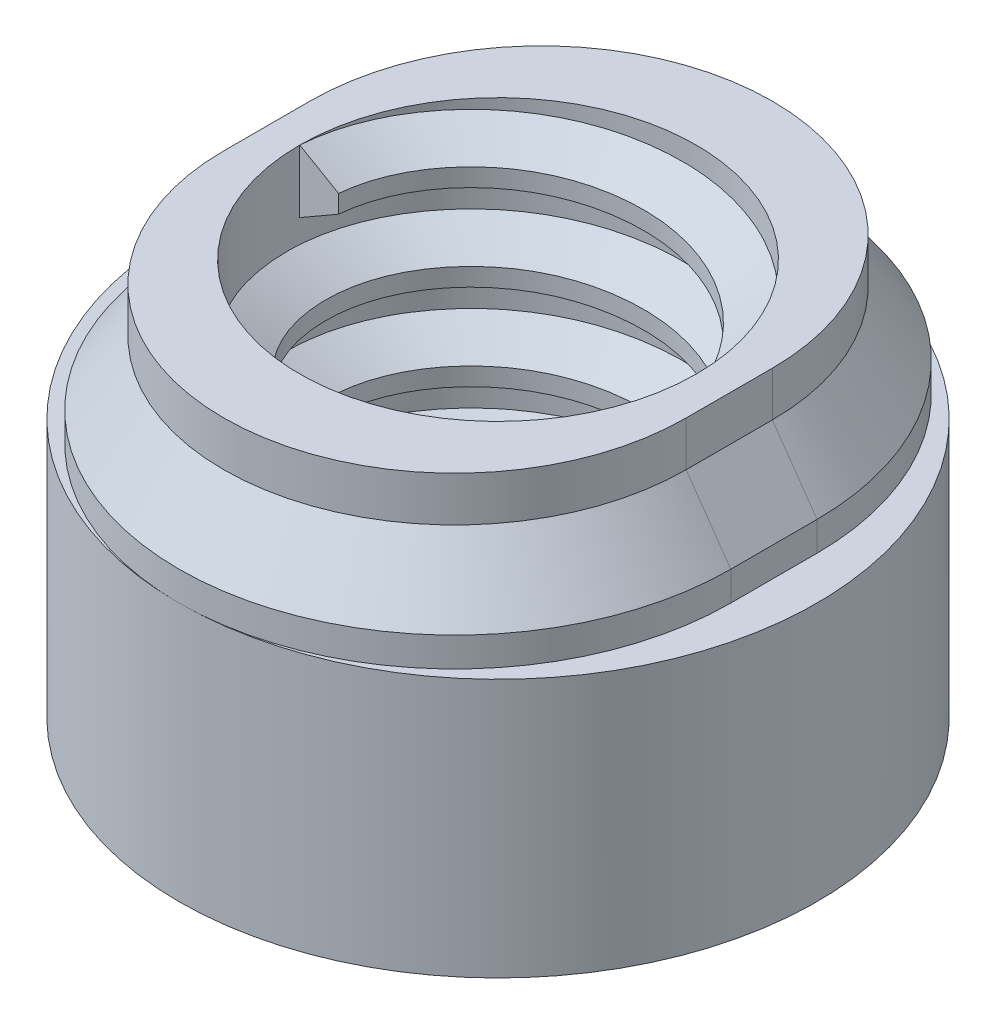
SolidWorks part; units mm, degrees
ref_plane "Front Plane" through (0, 0, 0) normal (0, 0, 1) x (1, 0, 0)
ref_plane "Top Plane" through (0, 0, 0) normal (0, 1, 0) x (1, 0, 0)
ref_plane "Right Plane" through (0, 0, 0) normal (1, 0, 0) x (0, 0, -1)
sketch "Sketch1" plane through (0, 0, 0) normal (0, 0, 1) x (1, 0, 0)
  line L0 (-6.35, 2.4765) -> (6.35, 2.4765) construction
  line L1 (-6.35, 0) -> (0, 0) construction
  line L2 (-6.35, -0.254) -> (-6.35, 0) construction
  line L3 (-6.35, 0) -> (-6.35, 2.4765) construction
  line L4 (0, 0) -> (0, 2.4765) construction
  circle A0 centre (-6.35, 2.4765) radius 2.7305
  circle A1 centre (6.35, 2.4765) radius 2.7305
  dimension "D1" = 5.461
  dimension "D2" = 12.7
  dimension "D3" = 0.254
extrude "Boss-Extrude1" add sketch "Sketch1" along normal blind 53.975
sketch "Sketch2" plane through (0, 0, 53.975) normal (0, 0, 1) x (1, 0, 0)
  circle A0 centre (-6.35, 2.4765) radius 4.7625
  circle A1 centre (6.35, 2.4765) radius 4.7625
  dimension "D1" = 9.525
extrude "Boss-Extrude2" add sketch "Sketch2" along normal blind 5.08
sketch "Sketch3" plane through (0, 0, 59.055) normal (0, 0, 1) x (1, 0, 0)
  line L0 (-6.35, 0.4445) -> (-6.35, 4.5085) construction
  line L3 (-6.858, 0.4445) -> (-6.858, 4.5085)
  line L6 (-5.842, 0.4445) -> (-5.842, 4.5085)
  line L7 (6.35, 0.4445) -> (6.35, 4.5085) construction
  line L8 (5.842, 0.4445) -> (5.842, 4.5085)
  line L9 (6.858, 0.4445) -> (6.858, 4.5085)
  circle A5 centre (6.35, 2.4765) radius 4.7625 construction
  circle A6 centre (-6.35, 2.4765) radius 4.7625 construction
  circle A7 centre (6.35, 2.4765) radius 4.7625 construction
  circle A8 centre (-6.35, 2.4765) radius 4.7625 construction
  arc A9 (-6.858, 0.4445) -> (-5.842, 0.4445) centre (-6.35, 0.4445) ccw
  arc A10 (-5.842, 4.5085) -> (-6.858, 4.5085) centre (-6.35, 4.5085) ccw
  arc A11 (5.842, 0.4445) -> (6.858, 0.4445) centre (6.35, 0.4445) ccw
  arc A12 (6.858, 4.5085) -> (5.842, 4.5085) centre (6.35, 4.5085) ccw
  point P7 (-6.35, 2.4765)
  point P13 (6.35, 2.4765)
  dimension "D1" = 4.064
  dimension "D2" = 1.016
  dimension "D3" = 1.016
extrude "Cut-Extrude1" cut sketch "Sketch3" against normal blind 3.81
thread "Thread1" pitch 1.27 start angle 0, offset 1.27, length 11.43, pitch 1.27, diameter 5.461
ref_plane "Plane1" through (9.0805, 2.4765, -1.27) normal (0, 1, 0) x (-1, 0, 0)
sketch "Thread Profile1" plane through (9.0805, 2.4765, -1.27) normal (0, 1, 0) x (-1, 0, 0)
  line L0 (0, 0) -> (0, 1.27) construction
  line L1 (0, 0) -> (0.6874, 0.3969)
  line L2 (0.6874, 0.3969) -> (0.6874, 0.5556)
  line L3 (0.6874, 0.5556) -> (0, 0.9525)
  line L4 (0.6874, 0.4762) -> (0, 0.4762) construction
  line L11 (0, 0) -> (0, 0.9525)
  point P2 (0, 0)
  dimension "Pitch" = 1.27
  dimension "Profile_Angle" = 60
  dimension "Profile_Land" = 0.1588
  dimension "Profile_Height" = 0.6874
thread "Thread2" pitch 1.27 start angle 0, offset 1.27, length 11.43, pitch 1.27, diameter 5.461
ref_plane "Plane2" through (-3.6195, 2.4765, -1.27) normal (0, 1, 0) x (-1, 0, 0)
sketch "Thread Profile2" plane through (-3.6195, 2.4765, -1.27) normal (0, 1, 0) x (-1, 0, 0)
  line L0 (0, 0) -> (0, 1.27) construction
  line L1 (0, 0) -> (0.6874, 0.3969)
  line L2 (0.6874, 0.3969) -> (0.6874, 0.5556)
  line L3 (0.6874, 0.5556) -> (0, 0.9525)
  line L4 (0.6874, 0.4762) -> (0, 0.4762) construction
  line L11 (0, 0) -> (0, 0.9525)
  point P2 (0, 0)
  dimension "Pitch" = 1.27
  dimension "Profile_Angle" = 60
  dimension "Profile_Land" = 0.1588
  dimension "Profile_Height" = 0.6874
sketch "Sketch9" plane through (0, 0, 0) normal (0, 1, 0) x (1, 0, 0)
  line L0 (-11.1125, -59.055) -> (-1.5875, -59.055) construction
  line L2 (1.5875, -59.055) -> (11.1125, -59.055) construction
  line L3 (6.35, -59.055) -> (6.35, -68.58) construction
  line L4 (-6.35, -59.055) -> (-6.35, -68.58) construction
  circle A0 centre (-6.35, -68.58) radius 4.699
  circle A1 centre (6.35, -68.58) radius 4.699
  circle A2 centre (-6.35, -68.58) radius 2.921
  circle A3 centre (6.35, -68.58) radius 2.921
  dimension "D2" = 9.398
  dimension "D3" = 5.842
  dimension "D1" = 9.525
extrude "Boss-Extrude3" add sketch "Sketch9" along normal blind 3.81 separate body
sketch "Sketch11" plane through (0, 3.81, 0) normal (0, 1, 0) x (1, 0, 0)
  line L0 (-6.35, -69.215) -> (-6.35, -67.945) construction
  line L1 (-10.414, -69.215) -> (-10.414, -67.945)
  line L2 (-2.286, -69.215) -> (-2.286, -67.945)
  line L3 (6.35, -69.215) -> (6.35, -67.945) construction
  line L4 (2.286, -69.215) -> (2.286, -67.945)
  line L5 (10.414, -69.215) -> (10.414, -67.945)
  circle A0 centre (6.35, -68.58) radius 4.699 construction
  circle A1 centre (-6.35, -68.58) radius 4.699 construction
  circle A2 centre (6.35, -68.58) radius 4.699 construction
  circle A3 centre (-6.35, -68.58) radius 4.699 construction
  arc A4 (-10.414, -69.215) -> (-2.286, -69.215) centre (-6.35, -69.215) ccw
  arc A5 (-2.286, -67.945) -> (-10.414, -67.945) centre (-6.35, -67.945) ccw
  arc A6 (2.286, -69.215) -> (10.414, -69.215) centre (6.35, -69.215) ccw
  arc A7 (10.414, -67.945) -> (2.286, -67.945) centre (6.35, -67.945) ccw
  circle A8 centre (-6.35, -68.58) radius 2.921
  circle A9 centre (6.35, -68.58) radius 2.921
  circle A10 centre (6.35, -68.58) radius 2.921 construction
  circle A11 centre (-6.35, -68.58) radius 2.921 construction
  point P8 (-6.35, -68.58)
  point P13 (6.35, -68.58)
  dimension "D1" = 8.128
  dimension "D2" = 8.128
extrude "Boss-Extrude4" add sketch "Sketch11" along normal blind 1.3716
chamfer "Chamfer1" distance 0.9398 angle 35 4 edges at (-6.35, 5.1816, 63.881) (-10.414, 5.1816, 68.58) (-2.286, 5.1816, 68.58) (-6.35, 5.1816, 73.279)
sketch "Sketch12" plane through (0, 5.1816, 0) normal (0, 1, 0) x (1, 0, 0)
  line L2 (-2.9441, -69.215) -> (-2.9441, -67.945)
  line L3 (-9.7559, -67.945) -> (-9.7559, -69.215)
  line L4 (-2.9441, -69.215) -> (-2.9441, -67.945)
  line L5 (-9.7559, -67.945) -> (-9.7559, -69.215)
  circle A0 centre (-6.35, -68.58) radius 2.921 construction
  circle A1 centre (-6.35, -68.58) radius 2.921
  arc A2 (-2.9441, -67.945) -> (-9.7559, -67.945) centre (-6.35, -67.945) ccw
  arc A3 (-9.7559, -69.215) -> (-2.9441, -69.215) centre (-6.35, -69.215) ccw
  arc A4 (-2.9441, -67.945) -> (-9.7559, -67.945) centre (-6.35, -67.945) ccw
  arc A5 (-9.7559, -69.215) -> (-2.9441, -69.215) centre (-6.35, -69.215) ccw
  dimension "D1" = 0
extrude "Boss-Extrude5" add sketch "Sketch12" along normal blind 0.6604
chamfer "Chamfer2" distance 0.9398 angle 35 4 edges at (6.35, 5.1816, 63.881) (2.286, 5.1816, 68.58) (10.414, 5.1816, 68.58) (6.35, 5.1816, 73.279)
sketch "Sketch13" plane through (0, 5.1816, 0) normal (0, 1, 0) x (1, 0, 0)
  line L2 (9.7559, -69.215) -> (9.7559, -67.945)
  line L3 (2.9441, -67.945) -> (2.9441, -69.215)
  line L4 (9.7559, -69.215) -> (9.7559, -67.945)
  line L5 (2.9441, -67.945) -> (2.9441, -69.215)
  circle A1 centre (6.35, -68.58) radius 2.921
  circle A2 centre (6.35, -68.58) radius 2.921
  arc A4 (9.7559, -67.945) -> (2.9441, -67.945) centre (6.35, -67.945) ccw
  arc A5 (2.9441, -69.215) -> (9.7559, -69.215) centre (6.35, -69.215) ccw
  arc A6 (9.7559, -67.945) -> (2.9441, -67.945) centre (6.35, -67.945) ccw
  arc A7 (2.9441, -69.215) -> (9.7559, -69.215) centre (6.35, -69.215) ccw
  dimension "D1" = 0
  dimension "D2" = 0
extrude "Boss-Extrude6" add sketch "Sketch13" along normal blind 0.6604
thread "Thread3" pitch 1.0583 start angle 0, offset 0, length 6.35, pitch 1.27, diameter 5.842
ref_plane "Plane3" through (-9.271, 5.842, 68.58) normal (0, 0, 1) x (-1, 0, 0)
sketch "Thread Profile3" plane through (-9.271, 5.842, 68.58) normal (0, 0, 1) x (-1, 0, 0)
  line L0 (0, 0) -> (0, 1.0583) construction
  line L11 (0, 0) -> (0, 0.926)
  line L12 (0, 0.926) -> (-0.5728, 0.5953)
  line L13 (-0.5728, 0.5953) -> (-0.5728, 0.3307)
  line L15 (-0.5728, 0.3307) -> (0, 0)
  line L17 (-0.5728, 0.463) -> (0, 0.463) construction
  point P2 (0, 0)
  dimension "Pitch" = 1.0583
  dimension "Profile_Angle" = 60
  dimension "Profile_Land" = 0.2646
  dimension "Profile_Height" = 0.5728
thread "Thread4" pitch 1.0583 start angle 0, offset 0, length 6.35, pitch 1.27, diameter 5.842
ref_plane "Plane4" through (3.429, 5.842, 68.58) normal (0, 0, 1) x (-1, 0, 0)
sketch "Thread Profile4" plane through (3.429, 5.842, 68.58) normal (0, 0, 1) x (-1, 0, 0)
  line L0 (0, 0) -> (0, 1.0583) construction
  line L11 (0, 0) -> (0, 0.926)
  line L12 (0, 0.926) -> (-0.5728, 0.5953)
  line L13 (-0.5728, 0.5953) -> (-0.5728, 0.3307)
  line L15 (-0.5728, 0.3307) -> (0, 0)
  line L17 (-0.5728, 0.463) -> (0, 0.463) construction
  point P2 (0, 0)
  dimension "Pitch" = 1.0583
  dimension "Profile_Angle" = 60
  dimension "Profile_Land" = 0.2646
  dimension "Profile_Height" = 0.5728
sketch "Sketch8" plane through (0, 0, 0) normal (0, 0, 1) x (1, 0, 0)
  line L1 (-12.7, 0) -> (12.7, 0)
  line L2 (-12.7, 0) -> (-12.7, -3.81)
  line L3 (-12.7, -3.81) -> (12.7, -3.81)
  line L4 (12.7, 0) -> (12.7, -3.81)
  point P9 (0, 0)
  dimension "D1" = 3.81
  dimension "D2" = 25.4
extrude "Cut-Extrude2" cut sketch "Sketch8" against normal through all both and the other way through all
sketch "Sketch14" plane through (0, 0, 0) normal (0, 1, 0) x (1, 0, 0)
  line L0 (-6.35, -59.055) -> (-6.35, 0) construction
  line L1 (-12.7, -73.9775) -> (0, -73.9775)
  line L2 (-12.7, -73.9775) -> (-12.7, 14.9225)
  line L3 (-12.7, 14.9225) -> (0, 14.9225)
  line L4 (0, -73.9775) -> (0, 14.9225)
  line L5 (-12.7, -73.9775) -> (0, 14.9225) construction
  line L6 (-12.7, 14.9225) -> (0, -73.9775) construction
  line L7 (-11.1125, -59.055) -> (-1.5875, -59.055) construction
  point P0 (-6.35, -29.5275)
  point P5 (-6.35, -29.5275)
  point P6 (-0.5717, -76.2115)
  dimension "D1" = 88.9
  dimension "D2" = 12.7
extrude "Cut-Extrude3" cut sketch "Sketch14" against normal through all both and the other way through all
sketch "Sketch15" plane through (0, 0, 0) normal (0, -1, 0) x (1, 0, 0)
  line L0 (6.35, 59.055) -> (6.35, 0) construction
  line L1 (11.1125, 59.055) -> (1.5875, 59.055) construction
  line L3 (12.7, -2.2225) -> (0, -2.2225)
  line L4 (12.7, -2.2225) -> (12.7, 61.2775)
  line L5 (12.7, 61.2775) -> (0, 61.2775)
  line L6 (0, -2.2225) -> (0, 61.2775)
  line L7 (12.7, -2.2225) -> (0, 61.2775) construction
  line L8 (12.7, 61.2775) -> (0, -2.2225) construction
  point P6 (6.35, 29.5275)
  dimension "D1" = 63.5
  dimension "D2" = 12.7
extrude "Cut-Extrude4" cut sketch "Sketch15" against normal through all both and the other way through all
